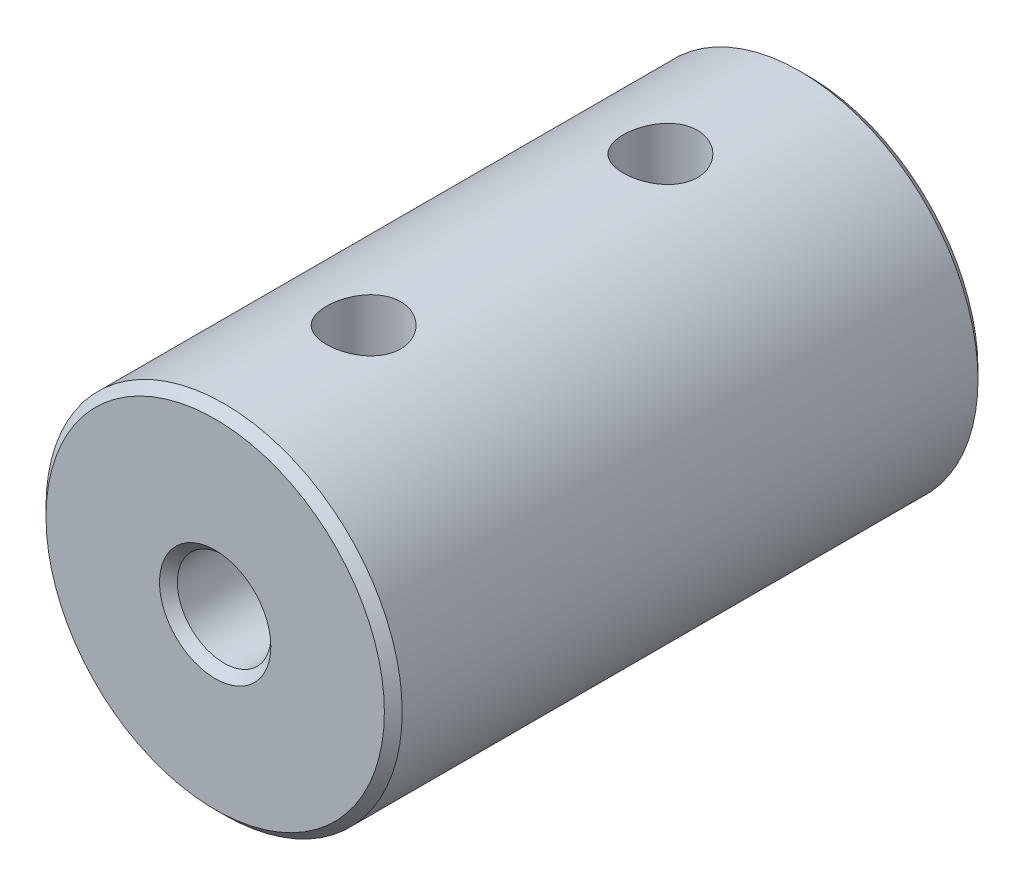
SolidWorks part; units mm, degrees
ref_plane "Plan de face" through (0, 0, 0) normal (0, 0, 1) x (1, 0, 0)
ref_plane "Plan de dessus" through (0, 0, 0) normal (0, 1, 0) x (1, 0, 0)
ref_plane "Plan de droite" through (0, 0, 0) normal (1, 0, 0) x (0, 0, -1)
sketch "Esquisse1" plane through (0, 0, 0) normal (0, 0, 1) x (1, 0, 0)
  circle A0 centre (0, 0) radius 6
  circle A1 centre (0, 0) radius 1.075
extrude "Boss.-Extru.1" add sketch "Esquisse1" along normal mid plane 20
sketch "Esquisse2" plane through (0, 0, 10) normal (0, 0, 1) x (1, 0, 0)
  circle A0 centre (0, 0) radius 1.575
extrude "Enlèv. mat.-Extru.1" cut sketch "Esquisse2" against normal blind 10
ref_plane "Plan1" through (0, 0, 0) normal (0, 1, 0) x (-1, 0, 0)
sketch "Esquisse3" plane through (0, 0, 0) normal (0, 1, 0) x (-1, 0, 0)
  line L0 (0, -2.4446) -> (0, 9.3829) construction
  line L1 (-5.1223, 0) -> (1.4849, 0) construction
  line L2 (-5.1223, 5) -> (1.4849, 5) construction
  circle A0 centre (0, 5) radius 1.25
  circle A1 centre (0, -5) radius 1.25
  dimension "D1" = 5
extrude "Enlèv. mat.-Extru.2" cut sketch "Esquisse3" against normal mid plane 12
chamfer "Chanfrein1" distance 0.3 angle 45 4 edges at (6, 0, -10) (1.075, 0, -10) (1.575, 0, 10) (6, 0, 10)
